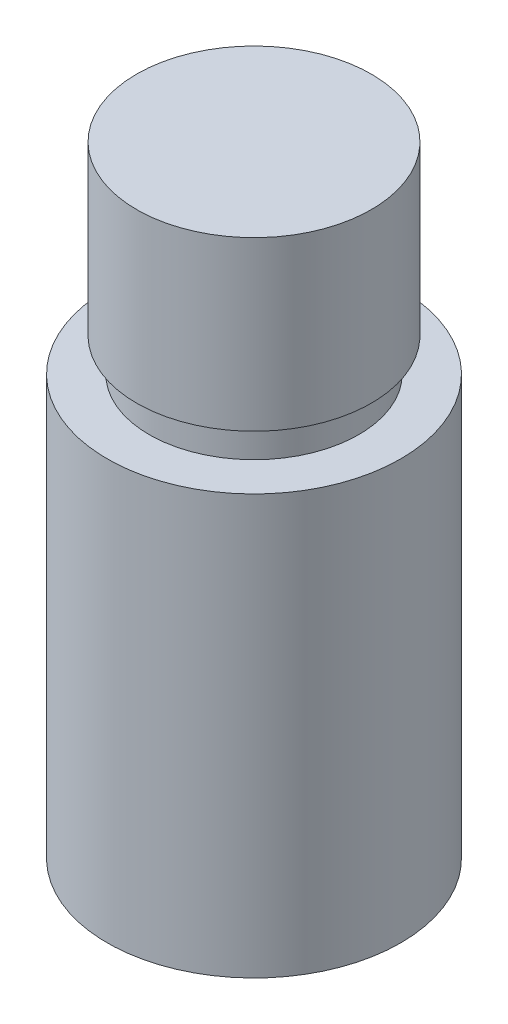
SolidWorks part; units mm, degrees
ref_plane "前视基准面" through (0, 0, 0) normal (0, 0, 1) x (1, 0, 0)
ref_plane "上视基准面" through (0, 0, 0) normal (0, 1, 0) x (1, 0, 0)
ref_plane "右视基准面" through (0, 0, 0) normal (1, 0, 0) x (0, 0, -1)
sketch "草图1" plane through (0, 0, 0) normal (0, 0, 1) x (1, 0, 0)
  line L0 (0, -91.5276) -> (0, 95.542) construction
  line L1 (0, -50) -> (-35, -50)
  line L2 (-35, -50) -> (-35, 50)
  line L3 (-35, 50) -> (-25, 50)
  line L4 (-25, 50) -> (-25, 58)
  line L5 (-25, 58) -> (-28, 58)
  line L6 (-28, 58) -> (-28, 98)
  line L7 (-28, 98) -> (0, 98)
  line L8 (0, 98) -> (0, -50)
  line L9 (0, 0) -> (-100.7606, 0) construction
  dimension "D1" = 100
  dimension "D2" = 8
  dimension "D3" = 40
  dimension "D4" = 35
  dimension "D5" = 25
  dimension "D6" = 28
revolve "旋转1" add sketch "草图1" angle 360 about L8
